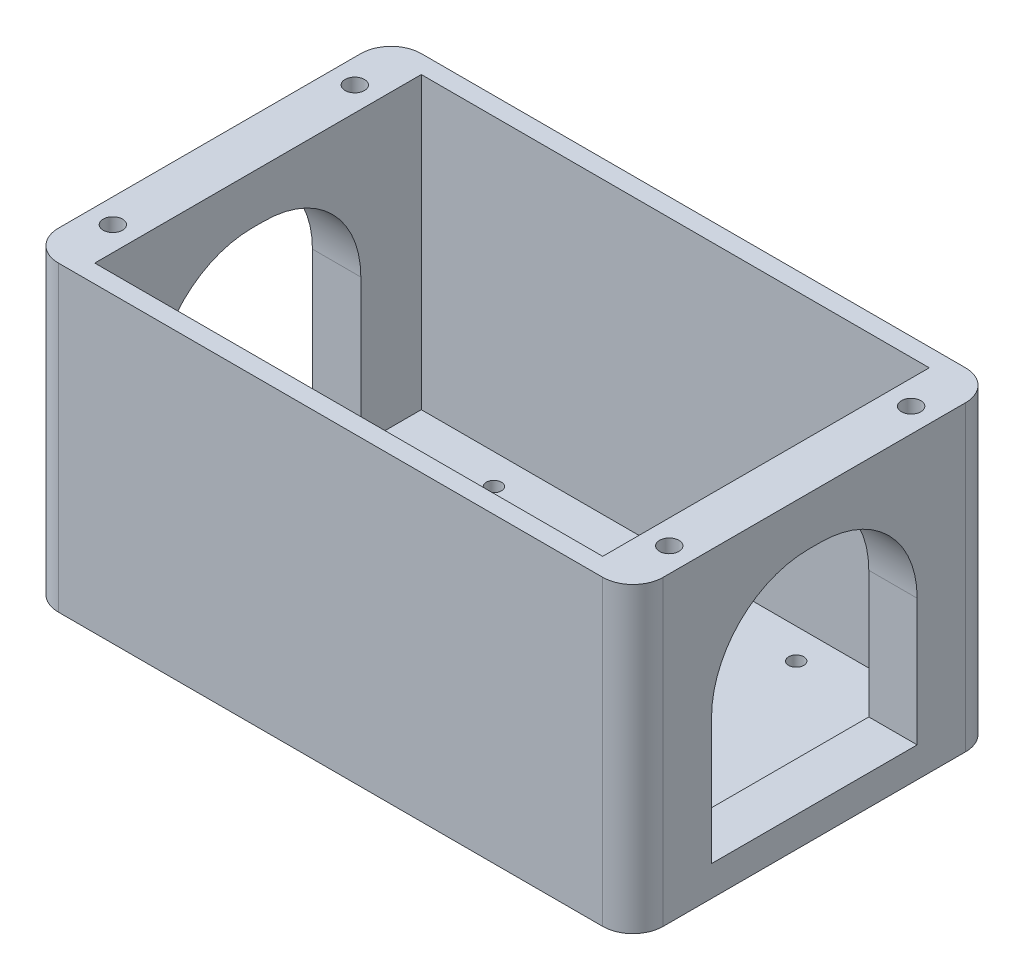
SolidWorks part; units mm, degrees
ref_plane "Front Plane" through (0, 0, 0) normal (0, 0, 1) x (1, 0, 0)
ref_plane "Top Plane" through (0, 0, 0) normal (0, 1, 0) x (1, 0, 0)
ref_plane "Right Plane" through (0, 0, 0) normal (1, 0, 0) x (0, 0, -1)
sketch "Sketch1" plane through (0, 0, 0) normal (0, 1, 0) x (1, 0, 0)
  line L0 (0, 0) -> (0, 137.1855) construction
  line L1 (0, 0) -> (127, 0)
  line L2 (0, 0) -> (0, 76.2)
  line L3 (0, 76.2) -> (127, 76.2)
  line L4 (127, 0) -> (127, 76.2)
  dimension "D1" = 127
  dimension "D2" = 76.2
extrude "Boss-Extrude1" add sketch "Sketch1" along normal blind 63.5
sketch "Sketch2" plane through (0, 63.5, 0) normal (0, 1, 0) x (1, 0, 0)
  line L1 (10.16, 3.81) -> (116.84, 3.81)
  line L2 (10.16, 3.81) -> (10.16, 72.39)
  line L3 (10.16, 72.39) -> (116.84, 72.39)
  line L4 (116.84, 3.81) -> (116.84, 72.39)
  line L5 (63.5, 0) -> (63.5, 91.8383) construction
  line L6 (0, 0) -> (127, 0) construction
  line L7 (63.5, 3.81) -> (63.5, 101.5196) construction
  line L8 (10.16, 38.1) -> (156.5079, 38.1) construction
  line L9 (0, 38.1) -> (-43.1019, 38.1) construction
  line L10 (0, 76.2) -> (0, 0) construction
  dimension "D1" = 68.58
  dimension "D2" = 106.68
extrude "Cut-Extrude2" cut sketch "Sketch2" against normal blind 60.96
sketch "Sketch5" plane through (0, 63.5, 0) normal (0, 1, 0) x (1, 0, 0)
  line L0 (0, 63.5) -> (140.5457, 63.5) construction
  line L1 (0, 76.2) -> (0, 0) construction
  line L2 (0, 12.7) -> (146.5137, 12.7) construction
  line L3 (127, 76.2) -> (0, 76.2) construction
  line L4 (0, 0) -> (127, 0) construction
  line L5 (127, 0) -> (127, 76.2) construction
  circle A0 centre (5.08, 63.5) radius 2.032
  circle A1 centre (5.08, 12.7) radius 2.032
  circle A2 centre (121.92, 63.5) radius 2.032
  circle A3 centre (121.92, 12.7) radius 2.032
  dimension "D3" = 4.064
  dimension "D4" = 4.064
  dimension "D5" = 4.064
  dimension "D6" = 4.064
  dimension "D1" = 12.7
  dimension "D2" = 12.7
  dimension "D7" = 5.08
  dimension "D8" = 5.08
  dimension "D9" = 5.08
  dimension "D10" = 5.08
extrude "Cut-Extrude4" cut sketch "Sketch5" against normal through all
fillet "Fillet1" radius 6.35 4 edges at (127, 31.75, 0) (0, 31.75, 0) (127, 31.75, -76.2) (0, 31.75, -76.2)
sketch "Sketch6" plane through (0, 2.54, 0) normal (0, 1, 0) x (1, 0, 0)
  line L0 (10.16, 3.81) -> (116.84, 3.81) construction
  line L1 (25.4, 3.81) -> (101.6, 3.81)
  line L2 (25.4, 3.81) -> (25.4, 72.39)
  line L3 (25.4, 72.39) -> (101.6, 72.39)
  line L4 (101.6, 3.81) -> (101.6, 72.39)
  line L5 (116.84, 72.39) -> (10.16, 72.39) construction
  line L6 (10.16, 72.39) -> (10.16, 3.81) construction
  dimension "D1" = 76.2
  dimension "D2" = 15.24
sketch "Sketch7" plane through (0, 0, 0) normal (0, -1, 0) x (1, 0, 0)
  line L0 (0, -38.1) -> (172.7849, -38.1) construction
  line L1 (0, -69.85) -> (0, -6.35) construction
  line L2 (63.5, -76.2) -> (63.5, 45.27) construction
  line L3 (120.65, -76.2) -> (6.35, -76.2) construction
  line L4 (31.75, -95.1866) -> (31.75, 61.1188) construction
  circle A0 centre (31.75, -66.04) radius 1.5875
  circle A1 centre (31.75, -10.16) radius 1.5875
  circle A2 centre (95.25, -10.16) radius 1.5875
  circle A3 centre (95.25, -66.04) radius 1.5875
  dimension "D1" = 3.175
  dimension "D2" = 27.94
  dimension "D3" = 31.75
extrude "Cut-Extrude6" cut sketch "Sketch7" against normal through all
sketch "Sketch8" plane through (0, 0, 0) normal (-1, 0, 0) x (0, 0, 1)
  line L0 (-69.85, 63.5) -> (-69.85, 0) construction
  line L1 (-59.69, 6.35) -> (-16.51, 6.35)
  line L2 (-59.69, 6.35) -> (-59.69, 33.02)
  line L3 (-39.37, 53.34) -> (-36.83, 53.34)
  line L4 (-16.51, 6.35) -> (-16.51, 33.02)
  line L5 (-6.35, 0) -> (-6.35, 63.5) construction
  line L6 (-69.85, 0) -> (-6.35, 0) construction
  line L7 (-69.85, 63.5) -> (-6.35, 63.5) construction
  arc A0 (-36.83, 53.34) -> (-16.51, 33.02) centre (-36.83, 33.02) cw
  arc A1 (-59.69, 33.02) -> (-39.37, 53.34) centre (-39.37, 33.02) cw
  dimension "D5" = 20.32
  dimension "D1" = 10.16
  dimension "D2" = 10.16
  dimension "D3" = 6.35
  dimension "D4" = 10.16
extrude "Cut-Extrude7" cut sketch "Sketch8" against normal through all
